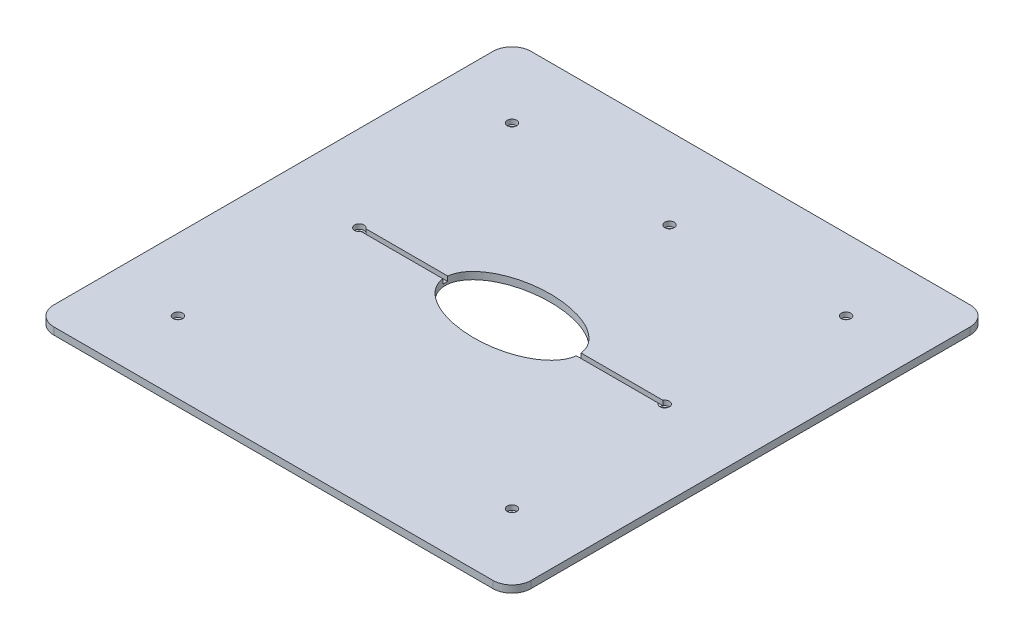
SolidWorks part; units mm, degrees
ref_plane "前视基准面" through (0, 0, 0) normal (0, 0, 1) x (1, 0, 0)
ref_plane "上视基准面" through (0, 0, 0) normal (0, 1, 0) x (1, 0, 0)
ref_plane "右视基准面" through (0, 0, 0) normal (1, 0, 0) x (0, 0, -1)
other "Configuration Table"
sketch "草图1" plane through (0, 0, 0) normal (0, 1, 0) x (1, 0, 0)
  line L1 (46, -50) -> (-46, -50)
  line L2 (50, -46) -> (50, 46)
  line L3 (46, 50) -> (-46, 50)
  line L4 (-50, -46) -> (-50, 46)
  line L5 (50, -50) -> (-50, 50) construction
  line L6 (50, 50) -> (-50, -50) construction
  arc A0 (-46, -50) -> (-50, -46) centre (-46, -46) cw
  arc A1 (46, -50) -> (50, -46) centre (46, -46) ccw
  arc A2 (46, 50) -> (50, 46) centre (46, 46) cw
  arc A3 (-50, 46) -> (-46, 50) centre (-46, 46) cw
  point P0 (0, 0)
  dimension "D3" = 4
  dimension "D1" = 100
  dimension "D2" = 100
extrude "凸台-拉伸1" add sketch "草图1" along normal blind 1.5
sketch "草图2" plane through (0, 1.5, 0) normal (0, 1, 0) x (1, 0, 0)
  ellipse E0 centre (0, 0) end of major axis (-14, 0) minor radius 8
sketch "草图3" plane through (0, 1.5, 0) normal (0, 1, 0) x (1, 0, 0)
  line L0 (46, 50) -> (-46, 50) construction
  line L1 (-50, 46) -> (-50, -46) construction
  circle A0 centre (-35, 35) radius 1
  circle A1 centre (35, 35) radius 1
  circle A2 centre (35, -35) radius 1
  circle A3 centre (-35, -35) radius 1
  point P0 (-35, 35)
  point P8 (35, 35)
  point P9 (35, -35)
  point P10 (-35, -35)
  point P11 (0, 0)
  point P20 (0, 0)
  dimension "D4" = 4
  dimension "D1" = 15
  dimension "D2" = 15
  dimension "D3" = 4
extrude "切除-拉伸1" cut sketch "草图3" against normal blind 1
sketch "草图4" plane through (0, 0.5, 0) normal (0, 1, 0) x (1, 0, 0)
  circle A0 centre (-35, 35) radius 0.805
  circle A1 centre (35, 35) radius 0.805
  circle A2 centre (35, -35) radius 0.805
  circle A3 centre (-35, -35) radius 0.805
  point P12 (0, 0)
  dimension "D1" = 4
extrude "切除-拉伸2" cut sketch "草图4" against normal blind 1
sketch "草图5" plane through (0, 0.5, 0) normal (0, 1, 0) x (1, 0, 0)
  circle A0 centre (-35, 35) radius 1
  circle A1 centre (35, 35) radius 1
  circle A2 centre (35, -35) radius 1
  circle A3 centre (-35, -35) radius 1
  point P12 (0, 0)
  dimension "D1" = 4
extrude "切除-拉伸3" cut sketch "草图5" against normal through all draft 45
extrude "切除-拉伸4" cut sketch "草图2" against normal through all
sketch "草图7" plane through (0, 1.5, 0) normal (0, 1, 0) x (1, 0, 0)
  line L1 (32, -0.5) -> (-32, -0.5)
  line L2 (32, -0.5) -> (32, 0.5)
  line L3 (32, 0.5) -> (-32, 0.5)
  line L4 (-32, -0.5) -> (-32, 0.5)
  line L5 (32, -0.5) -> (-32, 0.5) construction
  line L6 (32, 0.5) -> (-32, -0.5) construction
  point P0 (0, 0)
  dimension "D1" = 1
  dimension "D2" = 64
extrude "切除-拉伸6" cut sketch "草图7" against normal blind 1
sketch "草图10" plane through (0, 1.5, 0) normal (0, 1, 0) x (1, 0, 0)
  line L0 (-32, 0.5) -> (-32, -0.5) construction
  line L1 (32, -0.5) -> (32, 0.5) construction
  circle A0 centre (-32, 0) radius 1
  circle A1 centre (32, 0) radius 1
extrude "切除-拉伸7" cut sketch "草图10" against normal blind 1
sketch "草图11" plane through (0, 0.5, 0) normal (0, 1, 0) x (1, 0, 0)
  circle A0 centre (32, 0) radius 0.805
  circle A1 centre (-32, 0) radius 0.805
extrude "切除-拉伸8" cut sketch "草图11" against normal blind 1
sketch "草图12" plane through (0, 0.5, 0) normal (0, 1, 0) x (1, 0, 0)
  circle A0 centre (-32, 0) radius 1
  circle A1 centre (32, 0) radius 1
extrude "切除-拉伸9" cut sketch "草图12" against normal through all draft 45
sketch "草图13" plane through (0, 1.5, 0) normal (0, 1, 0) x (1, 0, 0)
  line L0 (0, 8) -> (0, 33) construction
  circle A0 centre (0, 33) radius 1
  ellipse E0 centre (0, 0) end of major axis (-14, 0) minor radius 8 (13.9726, 0.5) -> (-13.9726, 0.5) ccw construction
  dimension "D1" = 25
extrude "切除-拉伸10" cut sketch "草图13" against normal blind 1
sketch "草图14" plane through (0, 0.5, 0) normal (0, 1, 0) x (1, 0, 0)
  circle A0 centre (0, 33) radius 0.805
extrude "切除-拉伸11" cut sketch "草图14" against normal blind 1
sketch "草图15" plane through (0, 0.5, 0) normal (0, 1, 0) x (1, 0, 0)
  circle A0 centre (0, 33) radius 1
extrude "切除-拉伸12" cut sketch "草图15" against normal through all draft 45
